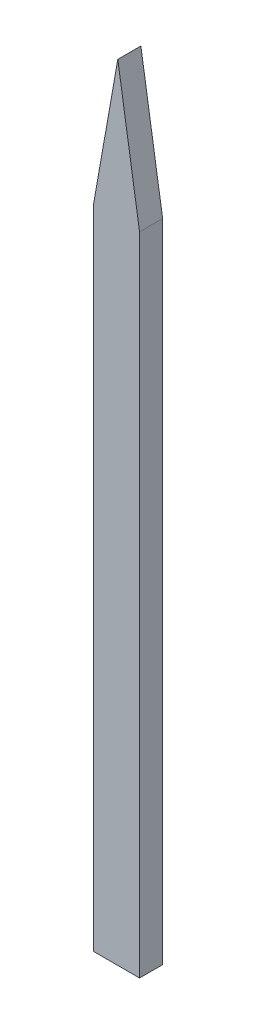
SolidWorks part; units mm, degrees
ref_plane "Face" through (0, 0, 0) normal (0, 0, 1) x (1, 0, 0)
ref_plane "Dessus" through (0, 0, 0) normal (0, 1, 0) x (1, 0, 0)
ref_plane "Droite" through (0, 0, 0) normal (1, 0, 0) x (0, 0, -1)
sketch "Esquisse1" plane through (0, 0, 0) normal (0, 0, 1) x (1, 0, 0)
  line L0 (0, 0) -> (0, 14)
  line L1 (0, 14) -> (0.529, 17)
  line L2 (0.529, 17) -> (1, 14)
  line L3 (1, 14) -> (1, 0)
  line L4 (1, 0) -> (0, 0)
  dimension "D1" = 1
  dimension "D2" = 14
  dimension "D3" = 14
  dimension "D4" = 17
  dimension "D5" = 190
extrude "Extrusion1" add sketch "Esquisse1" along normal blind 0.5
